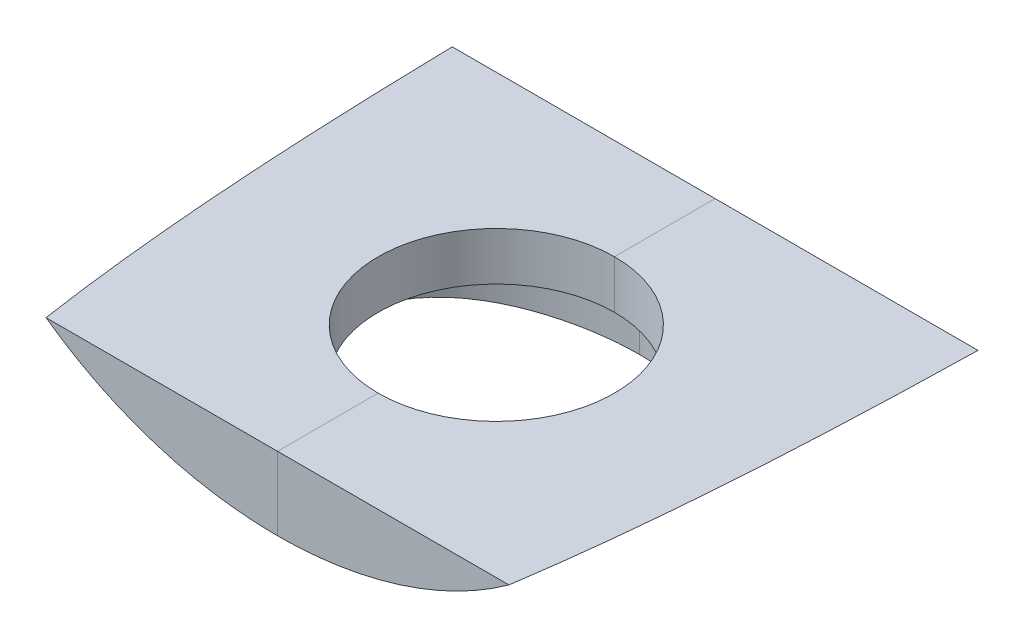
SolidWorks part; units mm, degrees
ref_plane "Front Plane" through (0, 0, 0) normal (0, 0, 1) x (1, 0, 0)
ref_plane "Top Plane" through (0, 0, 0) normal (0, 1, 0) x (1, 0, 0)
ref_plane "Right Plane" through (0, 0, 0) normal (1, 0, 0) x (0, 0, -1)
sketch "Sketch2" plane through (0, 0, 0) normal (0, 0, 1) x (1, 0, 0)
  line L2 (0, 0) -> (0, -11.5561) construction
  line L3 (30.5144, 0.0001) -> (-30.5144, -0.0001)
  spline S1 degree 3 poles (-30.5144, -0.0001) (-28.4159, -1.861) (-26.1803, -3.5016) (-22.63, -5.6456) (-21.4136, -6.3072) (-19.5389, -7.2193) (-18.9057, -7.5099) (-17.6222, -8.0636) (-16.9711, -8.3271) (-13.7053, -9.5624) (-11.0373, -10.3024) (-6.9545, -11.0502) (-5.58, -11.2387) (-3.4975, -11.4286) (-2.7988, -11.4764) (-1.3994, -11.5402) (-0.7016, -11.556) (2.7782, -11.5564) (5.5326, -11.307) (9.621, -10.5635) (10.9764, -10.2536) (12.9984, -9.693) (13.6705, -9.49) (14.9971, -9.0564) (15.6533, -8.8252) (18.9001, -7.5984) (21.3874, -6.3918) (24.9533, -4.2444) (26.1161, -3.4704) (28.3755, -1.8106) (29.4651, -0.9304) (30.5144, 0.0001) knots 0 0 0 0 0.125 0.125 0.1875 0.1875 0.21875 0.21875 0.25 0.25 0.375 0.375 0.4375 0.4375 0.46875 0.46875 0.5 0.5 0.625 0.625 0.6875 0.6875 0.71875 0.71875 0.75 0.75 0.875 0.875 0.9375 0.9375 1 1 1 1
  point P0 (0, -13.8827)
  dimension "D2" = 11.5561
  dimension "D3" = 61.0287
ref_plane "Plane1" through (0, 0, 50.8) normal (0, 0, 1) x (1, 0, 0)
sketch "Sketch3" plane through (0, 0, 50.8) normal (0, 0, 1) x (1, 0, 0)
  line L1 (0, 0) -> (0, -8.4949) construction
  line L2 (26.8702, -0.0002) -> (-26.8702, 0.0002)
  spline S1 degree 3 poles (-26.8702, 0.0002) (-24.9169, -1.4099) (-22.8732, -2.6337) (-18.6226, -4.7445) (-16.4154, -5.631) (-13.5537, -6.5271) (-12.9751, -6.696) (-11.8167, -7.0098) (-11.236, -7.155) (-9.4899, -7.5567) (-8.3203, -7.779) (-4.7953, -8.3131) (-2.424, -8.4933) (1.1656, -8.4957) (2.3717, -8.451) (4.7585, -8.2723) (5.9425, -8.1386) (9.4669, -7.6068) (11.7798, -7.0787) (15.1923, -6.0162) (16.3202, -5.6166) (18.5559, -4.7226) (19.6505, -4.2334) (22.8655, -2.6396) (24.9172, -1.4101) (26.8702, -0.0002) knots 0 0 0 0 0.125 0.125 0.25 0.25 0.28125 0.28125 0.3125 0.3125 0.375 0.375 0.5 0.5 0.5625 0.5625 0.625 0.625 0.75 0.75 0.8125 0.8125 0.875 0.875 1 1 1 1
  point P0 (0, 0)
  dimension "D2" = 8.4949
  dimension "D3" = 53.7404
sketch "Sketch5" plane through (0, 0, 0) normal (1, 0, 0) x (0, 0, -1)
  line L0 (-117.5219, 14.189) -> (-117.5219, -11.811) construction
  line L1 (0, -11.5561) -> (0, -11.811) construction
  line L2 (-117.5219, -11.811) -> (22.4781, -11.811) construction
  line L3 (0, 0) -> (0, -11.5561) construction
  spline S0 degree 3 number of poles 202 (-50.8, -8.4949) -> (0, -11.5561)
  point P4 (0, -11.5561)
  point P9 (0, -11.5561)
  dimension "D1" = 22.4781
  dimension "D2" = 26
  dimension "D3" = 140
sketch "Sketch6" plane through (0, 0, 0) normal (1, 0, 0) x (0, 0, -1)
  line L0 (0, 0) -> (-50.8, 0)
sketch "Sketch8" plane through (0, 0, 0) normal (0, 1, 0) x (1, 0, 0)
  line L0 (-30.5141, 0) -> (-26.8699, 0) construction
  line L1 (-26.8702, -50.8) -> (26.8702, -50.8) construction
  line L2 (-26.8699, -50.8) -> (-26.8699, 0) construction
  line L3 (-30.5144, 0) -> (30.5144, 0) construction
  line L4 (0, 0) -> (0, -50.8) construction
  spline S1 degree 3 poles (-26.8699, -50.8) (-27.5053, -46.5905) (-28.0156, -42.372) (-28.8661, -33.9227) (-29.2058, -29.692) (-30.0361, -16.9862) (-30.3368, -8.4975) (-30.5141, 0) knots 0 0 0 0 0.25 0.25 0.5 0.5 1 1 1 1
  point P0 (-26.8699, -50.8)
  point P8 (30.5143, 0)
  point P14 (30.5143, 0)
  dimension "D1" = 50.8
  dimension "D2" = 3.6442
sketch "Sketch9" plane through (0, 0, 0) normal (0, 1, 0) x (1, 0, 0)
  line L0 (0, -50.8) -> (0, 0) construction
  line L1 (-26.8702, -50.8) -> (26.8702, -50.8) construction
  line L2 (26.8702, -50.8) -> (-26.8702, -50.8) construction
  line L3 (0, -50.8) -> (26.8699, -50.8) construction
  line L4 (-26.8699, -50.8) -> (0, -50.8) construction
  spline S0 degree 3 poles (-26.8699, -50.8) (-27.5053, -46.5905) (-28.0156, -42.372) (-28.8661, -33.9227) (-29.2058, -29.692) (-30.0361, -16.9862) (-30.3368, -8.4975) (-30.5141, 0) knots 0 0 0 0 0.25 0.25 0.5 0.5 1 1 1 1 only from (-26.8699, -50.8) to (-30.5143, 0) construction
  spline S2 degree 3 poles (26.8699, -50.8) (27.5053, -46.5905) (28.0157, -42.372) (28.8661, -33.9227) (29.2059, -29.692) (30.0362, -16.9862) (30.337, -8.4975) (30.5143, 0) knots 0 0 0 0 0.25 0.25 0.5 0.5 1 1 1 1
  point P16 (-26.8699, -50.8)
loft "Loft4" add profiles "Sketch2", "Sketch3"
sketch "Sketch13" plane through (0, 0, 0) normal (0, 1, 0) x (1, 0, 0)
  line L0 (0, -25.4) -> (0, 0) construction
  line L1 (0, -25.4) -> (0, -50.8) construction
  line L2 (26.8702, -50.8) -> (-26.8702, -50.8) construction
  circle A0 centre (0, -25.4) radius 16.637
  dimension "D1" = 33.274
extrude "Cut-Extrude2" cut sketch "Sketch13" against normal through all both and the other way through all
sketch "Sketch16" plane through (0, 0, 0) normal (0, 1, 0) x (1, 0, 0)
  line L0 (0, -8.255) -> (0, -11.684) construction
  line L1 (0, -11.684) -> (0, -39.116) construction
  line L2 (0, -39.116) -> (0, -42.545) construction
  circle A0 centre (0, -25.4) radius 17.145
  circle A2 centre (0, -25.4) radius 13.716
  dimension "D1" = 27.432
  dimension "D2" = 34.29
extrude "Boss-Extrude1" add sketch "Sketch16" against normal blind 5.588
ref_plane "Plane2" through (-7.62, 0, 0) normal (1, 0, 0) x (0, 0, -1)
sketch "Sketch17" plane through (-7.62, 0, 0) normal (1, 0, 0) x (0, 0, -1)
  line L0 (-5.08, -5.08) -> (-45.72, -5.08) construction
  line L1 (0, -11.5561) -> (0, 0.0001) construction
  line L2 (-50.8, 0.0002) -> (-50.8, -8.4949) construction
  line L3 (-1.905, -5.08) -> (-1.905, -13.97)
  line L4 (-1.905, -13.97) -> (-8.255, -13.97)
  line L5 (-8.255, -13.97) -> (-8.255, -5.08)
  line L6 (-42.545, -5.08) -> (-42.545, -13.97)
  line L7 (-42.545, -13.97) -> (-48.895, -13.97)
  line L8 (-48.895, -13.97) -> (-48.895, -5.08)
  line L9 (-42.545, -13.97) -> (-8.255, -13.97) construction
  arc A0 (-42.545, -5.08) -> (-48.895, -5.08) centre (-45.72, -5.08) ccw
  arc A1 (-1.905, -5.08) -> (-8.255, -5.08) centre (-5.08, -5.08) ccw
  point P15 (-8.201, -14.9227)
  dimension "D3" = 6.35
  dimension "D4" = 6.35
  dimension "D1" = 5.08
  dimension "D2" = 5.08
  dimension "D5" = 5.08
  dimension "D6" = 8.89
extrude "Cut-Extrude4" cut sketch "Sketch17" against normal through all
sketch "Sketch18" plane through (0, 0, 0) normal (0, 1, 0) x (1, 0, 0)
  line L0 (26.8702, -50.8) -> (-26.8702, -50.8) construction
  line L1 (30.5144, 0) -> (0, 0)
  line L2 (30.5144, 0) -> (30.5144, -50.8)
  line L3 (30.5144, -50.8) -> (0, -50.8)
  line L4 (0, 0) -> (0, -50.8)
  line L5 (30.5144, 0) -> (-30.5144, 0) construction
  spline S0 degree 3 poles (30.5144, 0) (30.2484, -12.7463) (29.5471, -29.7165) (27.5053, -46.5905) (26.8702, -50.8) knots 0 0 0 0 0.75 1 1 1 1 construction
  point P7 (0, 0)
  point P8 (30.5144, 0)
extrude "Cut-Extrude5" cut sketch "Sketch18" against normal through all both and the other way through all contours L2 L3 L4 L1
sketch "Sketch19" plane through (0, 0, 0) normal (0, 1, 0) x (1, 0, 0)
  line L1 (0, -50.8) -> (-30.5144, -50.8)
  line L2 (0, -50.8) -> (0, 0)
  line L3 (0, 0) -> (-30.5144, 0)
  line L4 (-30.5144, -50.8) -> (-30.5144, 0)
extrude "Cut-Extrude6" cut sketch "Sketch19" along normal blind 5.08
hole_wizard "#4 Clearance Hole1" positions "Sketch21" profile "Sketch22" hole size "#4" standard "Superior"
sketch "Sketch21" plane through (-7.62, 0, 0) normal (-1, 0, 0) x (0, 0, 1)
  point P0 (5.08, -5.08)
  point P3 (45.72, -5.08)
sketch "Sketch22" plane through (-7.62, -5.08, 5.08) normal (0, 1, 0) x (0, 0, 1)
  line L0 (0, 0) -> (0, 8.6746)
  line L1 (0, 8.6746) -> (1.7272, 8.6746)
  line L2 (1.7272, 8.6746) -> (1.7272, 0)
  line L5 (1.7272, 0) -> (0, 0)
  line L11 (0, -6.35) -> (0, 107.95) construction
  dimension "Thru Hole Dia." = 3.4544
  dimension "Thru Hole Depth" = 8.6746
fillet "Fillet1" radius 1.27 8 edges at (-24.7937, -1.9091, 45.5586) (-28.0555, -1.9056, 5.0176)
chamfer "Chamfer1" distance 1.905 angle 45 1 edges at (-16.637, -5.588, 25.4)
mirror "Mirror1" about plane through (0, -11.5615, 0) normal (-1, 0, 0)
